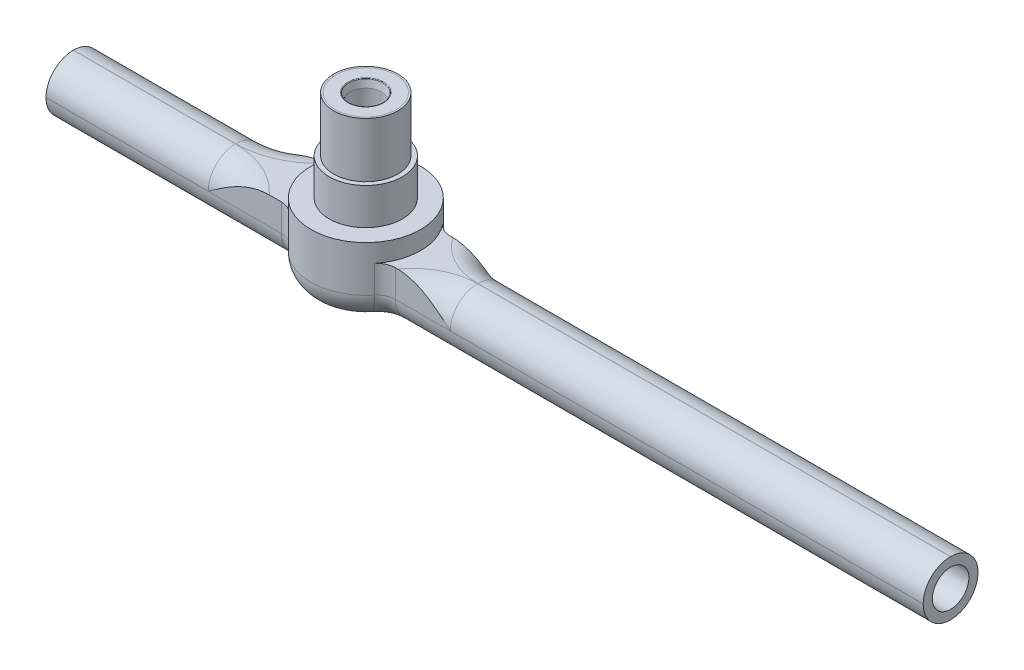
SolidWorks part; units mm, degrees
ref_plane "Front Plane" through (0, 0, 0) normal (0, 0, 1) x (1, 0, 0)
ref_plane "Top Plane" through (0, 0, 0) normal (0, 1, 0) x (1, 0, 0)
ref_plane "Right Plane" through (0, 0, 0) normal (1, 0, 0) x (0, 0, -1)
sketch "Sketch1" plane through (0, 0, 0) normal (0, 0, 1) x (1, 0, 0)
  line L1 (203.2, -57.15) -> (-101.6, -57.15)
  line L2 (-101.6, -57.15) -> (-101.6, -38.1)
  line L3 (-101.6, -38.1) -> (-19.05, -38.1)
  line L4 (-19.05, -38.1) -> (-19.05, 0)
  line L5 (-19.05, 0) -> (19.05, 0)
  line L6 (19.05, 0) -> (19.05, -38.1)
  line L7 (19.05, -38.1) -> (203.2, -38.1)
  line L8 (203.2, -38.1) -> (203.2, -57.15)
  dimension "D1" = 38.1
  dimension "D2" = 19.05
  dimension "D3" = 101.6
  dimension "D4" = 203.2
  dimension "D5" = 38.1
extrude "Boss-Extrude1" add sketch "Sketch1" along normal mid plane 38.1
sketch "Sketch23" plane through (0, 0, 0) normal (0, 0, 1) x (1, 0, 0)
  line L0 (0, 0) -> (0, -46.5949) construction
  line L1 (11.1125, 0) -> (11.1125, -19.05)
  line L2 (19.05, 0) -> (-19.05, 0) construction
  line L3 (11.1125, -19.05) -> (12.7, -19.05)
  line L5 (12.7, -19.05) -> (12.7, -31.75)
  line L6 (12.7, -31.75) -> (19.05, -31.75)
  line L7 (59.7948, 0) -> (11.1125, 0)
  line L8 (59.7948, -38.1) -> (59.7948, 0)
  line L9 (19.05, -31.75) -> (19.05, -38.1)
  line L11 (19.05, -38.1) -> (59.7948, -38.1)
  line L12 (203.2, -38.1) -> (19.05, -38.1) construction
  dimension "D1" = 22.225
  dimension "D2" = 6.35
  dimension "D3" = 12.7
  dimension "D4" = 25.4
  dimension "D5" = 38.1
revolve "Cut-Revolve2" cut sketch "Sketch23" angle 360 about L0
sketch "Sketch3" plane through (0, -38.1, 0) normal (0, 1, 0) x (1, 0, 0)
  line L1 (-101.6, -9.525) -> (-101.6, -24.2049)
  line L2 (-101.6, -24.2049) -> (203.2, -24.2049)
  line L3 (-101.6, 9.525) -> (-16.4978, 9.525)
  line L4 (203.2, -24.2049) -> (203.2, -9.525)
  line L5 (203.2, 24.2049) -> (203.2, 9.525)
  line L6 (-101.6, 24.2049) -> (203.2, 24.2049)
  line L7 (203.2, 9.525) -> (16.4978, 9.525)
  line L8 (-101.6, 9.525) -> (-101.6, 24.2049)
  line L10 (0, 0) -> (-142.5492, 0) construction
  line L12 (203.2, -9.525) -> (16.4978, -9.525)
  line L16 (-101.6, -9.525) -> (-16.4978, -9.525)
  arc A0 (-16.4978, 9.525) -> (16.4978, 9.525) centre (0, 0) cw
  arc A1 (-16.4978, -9.525) -> (16.4978, -9.525) centre (0, 0) ccw
  arc A3 (0, -19.05) -> (0, 19.05) centre (0, 0) ccw construction
  dimension "D3" = 9.525
extrude "Cut-Extrude2" cut sketch "Sketch3" against normal through all
fillet "Fillet1" radius 6.35 4 edges at (16.4978, -47.625, 9.525) (16.4978, -47.625, -9.525) (-16.4978, -47.625, -9.525) (-16.4978, -47.625, 9.525)
sketch "Sketch5" plane through (0, -38.1, 0) normal (0, 1, 0) x (1, 0, 0)
  line L0 (203.2, -9.525) -> (38.8779, -9.525)
  line L1 (203.2, -9.525) -> (19.8279, -9.525) construction
  line L2 (26.1779, -22.225) -> (26.1779, -36.8773)
  arc A0 (38.8779, -9.525) -> (26.1779, -22.225) centre (38.8779, -22.225) ccw
  point P8 (26.1779, -9.525)
  dimension "D1" = 12.7
  dimension "D2" = 6.35
fillet "Fillet2" radius 9.525 2 edges at (111.5139, -57.15, -9.525) (-60.7139, -57.15, -9.525)
fillet "Fillet3" radius 9.525 5 edges at (111.5139, -57.15, 9.525) (17.0782, -57.15, 10.1512) (0, -57.15, 19.05) (-60.7139, -57.15, 9.525) (-17.0782, -57.15, 10.1512)
sketch "Sketch6" plane through (203.2, 0, 0) normal (1, 0, 0) x (0, 0, -1)
  line L0 (-9.525, -38.1) -> (-9.525, -47.625) construction
  line L1 (-9.525, -38.1) -> (9.525, -38.1) construction
  line L2 (-9.525, -47.625) -> (-9.525, -38.1) construction
  line L4 (0, -38.1) -> (0, -49.2243) construction
  line L6 (-0.0635, -38.1) -> (-9.525, -38.1)
  line L7 (-9.525, -38.1) -> (-11.9062, -38.1) construction
  line L8 (-9.525, -38.1) -> (-9.525, -47.5615)
  arc A0 (-9.525, -47.5615) -> (-0.0635, -38.1) centre (-0.0635, -47.5615) cw
  dimension "D1" = 0.0635
sweep "Cut-Sweep1" cut profiles "Sketch6" path "Sketch5"
sketch "Sketch10" plane through (-101.6, 0, 0) normal (-1, 0, 0) x (0, 0, 1)
  line L0 (0, -38.1) -> (0, -57.15) construction
  line L1 (9.525, -38.1) -> (-9.525, -38.1) construction
  line L3 (-9.525, -47.625) -> (-9.525, -38.1) construction
  line L4 (-0.0635, -38.1) -> (-9.525, -38.1)
  line L5 (-9.525, -38.1) -> (-9.525, -47.5615)
  arc A0 (-9.525, -47.5615) -> (-0.0635, -38.1) centre (-0.0635, -47.5615) cw
  dimension "D1" = 0.0635
sketch "Sketch11" plane through (0, -38.1, 0) normal (0, 1, 0) x (1, 0, 0)
  line L0 (-101.6, 9.525) -> (-45.2279, 9.525)
  line L2 (-26.1779, 28.575) -> (-26.1779, 40.5965)
  line L3 (-101.6, 9.525) -> (-19.8279, 9.525) construction
  arc A0 (-45.2279, 9.525) -> (-26.1779, 28.575) centre (-45.2279, 28.575) ccw
  point P8 (-26.1779, 9.525)
  dimension "D1" = 19.05
  dimension "D2" = 6.35
sweep "Cut-Sweep2" cut profiles "Sketch10" path "Sketch11"
mirror "Mirror1" about plane through (0, 0, 0) normal (0, 0, 1) of "Cut-Sweep2", "Cut-Sweep1"
hole_wizard "1/2 (0.5) Diameter Hole1" positions "Sketch9" profile "Sketch8" hole size "1/2" standard "ANSI Inch"
sketch "Sketch9" plane through (203.2, 0, 0) normal (1, 0, 0) x (0, 0, -1)
  line L0 (0, -38.1) -> (0, -57.15) construction
  line L1 (-0.0635, -38.1) -> (0.0635, -38.1) construction
  point P0 (0, -47.625)
sketch "Sketch8" plane through (203.2, -47.625, 0) normal (0, 1, 0) x (0, 0, -1)
  line L0 (0, 0) -> (0, 207.0155)
  line L1 (0, 207.0155) -> (6.35, 203.2)
  line L2 (6.35, 203.2) -> (6.35, 0)
  line L5 (6.35, 0) -> (0, 0)
  line L10 (0, 207.0155) -> (-6.35, 203.2) construction
  line L11 (0, -6.35) -> (0, 107.95) construction
  dimension "Hole Dia." = 12.7
  dimension "Hole Depth" = 203.2
  dimension "Drill Angle" = 118
hole_wizard "1/2 (0.5) Diameter Hole2" positions "Sketch13" profile "Sketch12" hole size "1/2" standard "ANSI Inch"
sketch "Sketch13" plane through (-101.6, 0, 0) normal (-1, 0, 0) x (0, 0, 1)
  line L0 (0, -38.1) -> (0, -57.15) construction
  line L1 (0.0635, -38.1) -> (-0.0635, -38.1) construction
  point P0 (0, -47.625)
sketch "Sketch12" plane through (-101.6, -47.625, 0) normal (0, 1, 0) x (0, 0, 1)
  line L0 (0, 0) -> (0, 105.4155)
  line L1 (0, 105.4155) -> (6.35, 101.6)
  line L2 (6.35, 101.6) -> (6.35, 0)
  line L5 (6.35, 0) -> (0, 0)
  line L10 (0, 105.4155) -> (-6.35, 101.6) construction
  line L11 (0, -6.35) -> (0, 107.95) construction
  dimension "Hole Dia." = 12.7
  dimension "Hole Depth" = 101.6
  dimension "Drill Angle" = 118
sketch "Sketch2" plane through (-0.326, 0, -1.7461) normal (0, -1, 0) x (1, 0, 0)
  line L0 (-0.3802, 4.8416) -> (1.0323, -1.3493) construction
  line L1 (3.175, 0) -> (-3.0159, -1.4125) construction
  circle A0 centre (0.326, 1.7461) radius 11.1125 construction
  point P5 (0.326, 1.7461)
  dimension "D3" = 6.35
ref_plane "Plane1" through (0, 0, 0) normal (0.2224, 0, -0.9749) x (-0.9749, 0, -0.2224)
sketch "Port Sketch" plane through (2.7396, 0, 0.6251) normal (-0.2224, 0, 0.9749) x (-0.9749, 0, -0.2224)
  line L0 (2.81, 0) -> (2.81, 45.0293) construction
  line L1 (2.81, 16.9809) -> (7.7706, 14.0003)
  line L2 (7.7706, 14.0003) -> (7.7706, 11.5003)
  line L3 (7.7706, 11.5003) -> (8.3663, 11.5003)
  line L4 (8.3663, 11.5003) -> (8.3663, 2.5107)
  line L5 (8.3663, 2.5107) -> (8.2767, 2.6003)
  line L6 (8.2767, 2.6003) -> (8.7866, 0.2014)
  line L7 (9.035, 0.0003) -> (13.31, 0.0003)
  line L8 (13.31, 0.0003) -> (13.31, 0)
  line L10 (13.31, 0) -> (2.81, 0)
  line L11 (2.81, 0) -> (2.81, 16.9809)
  line L12 (-2.6567, 2.6003) -> (-3.1665, 0.2014) construction
  line L13 (-2.7462, 2.5107) -> (-2.6567, 2.6003) construction
  line L14 (2.81, 16.9809) -> (-2.1506, 14.0003) construction
  arc A0 (8.7866, 0.2014) -> (9.035, 0.0003) centre (9.035, 0.2543) ccw
  dimension "D1" = 0.254
  dimension "Countersink angle" = 118
  dimension "D3" = 45
  dimension "TapDrillDia" = 9.9212
  dimension "D5" = 12.45
  dimension "ThdMjr" = 11.1125
  dimension "SpotDia" = 21
  dimension "L3" = 0.0003
  dimension "L1" = 2.6
  dimension "ThdDp" = 11.5
  dimension "TapDrillDp" = 14
  dimension "K" = 12
revolve "SAE Port" cut sketch "Port Sketch" angle 360 about L0
other "sae j1926-1 (circular face)<1>"
